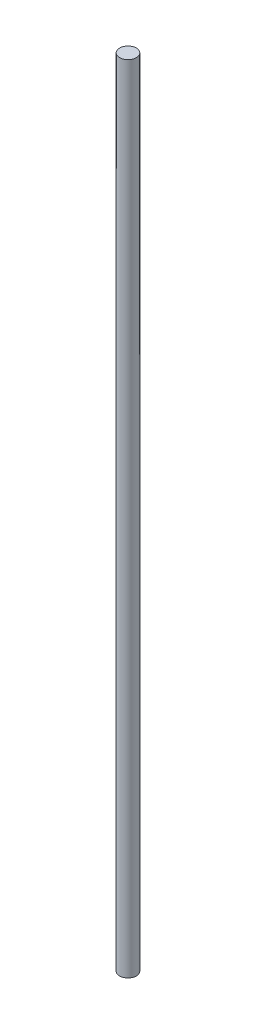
SolidWorks part; units mm, degrees
ref_plane "Front Plane" through (0, 0, 0) normal (0, 0, 1) x (1, 0, 0)
ref_plane "Top Plane" through (0, 0, 0) normal (0, 1, 0) x (1, 0, 0)
ref_plane "Right Plane" through (0, 0, 0) normal (1, 0, 0) x (0, 0, -1)
sketch "Sketch1" plane through (0, 0, 0) normal (0, 1, 0) x (1, 0, 0)
  circle A0 centre (0, 0) radius 4
  dimension "D1" = 8
extrude "Boss-Extrude1" add sketch "Sketch1" along normal blind 381 contours A0
